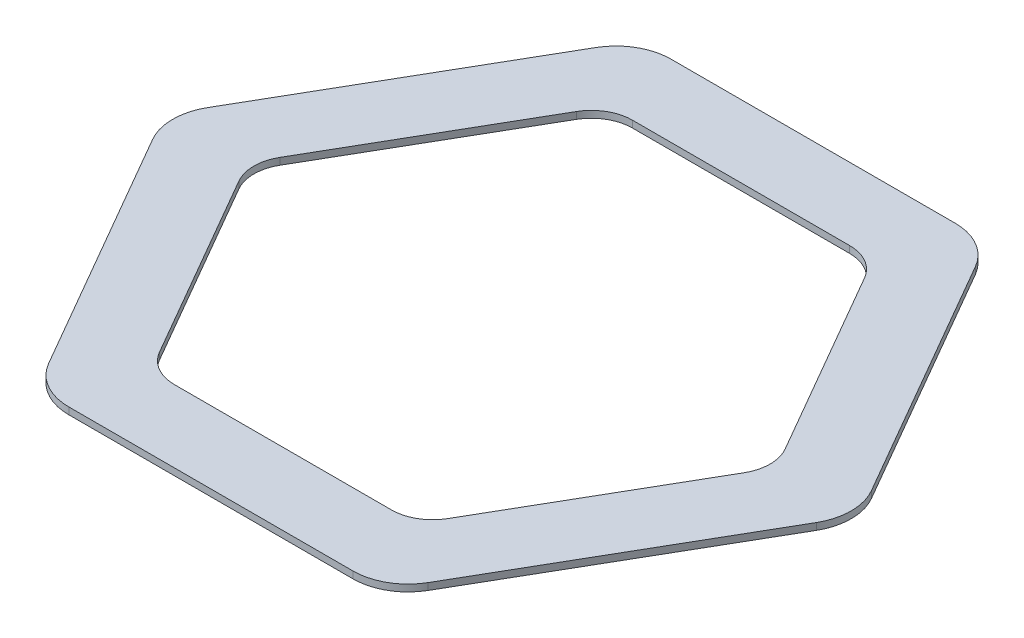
SolidWorks part; units mm, degrees
ref_plane "Plan de face" through (0, 0, 0) normal (0, 0, 1) x (1, 0, 0)
ref_plane "Plan de dessus" through (0, 0, 0) normal (0, 1, 0) x (1, 0, 0)
ref_plane "Plan de droite" through (0, 0, 0) normal (1, 0, 0) x (0, 0, -1)
sketch "Esquisse1" plane through (0, 0, 0) normal (0, 1, 0) x (1, 0, 0)
  line L0 (-55.5122, 80.05) -> (-97.0814, 8.05)
  line L1 (98.7269, 9) -> (57.1577, 81) construction
  line L2 (41.5692, 90) -> (-41.5692, 90) construction
  line L3 (-57.1577, 81) -> (-98.7269, 9) construction
  line L4 (-98.7269, -9) -> (-57.1577, -81) construction
  line L5 (-41.5692, -90) -> (41.5692, -90) construction
  line L6 (57.1577, -81) -> (98.7269, -9) construction
  line L7 (-97.0814, -8.05) -> (-55.5122, -80.05)
  line L8 (-41.5692, -88.1) -> (41.5692, -88.1)
  line L9 (55.5122, -80.05) -> (97.0814, -8.05)
  line L10 (97.0814, 8.05) -> (55.5122, 80.05)
  line L11 (41.5692, 88.1) -> (-41.5692, 88.1)
  line L12 (-42.1466, 61) -> (-73.9008, 6)
  line L13 (72.1688, 5) -> (40.4145, 60) construction
  line L14 (31.7543, 65) -> (-31.7543, 65) construction
  line L15 (-40.4145, 60) -> (-72.1688, 5) construction
  line L16 (-72.1688, -5) -> (-40.4145, -60) construction
  line L17 (-31.7543, -65) -> (31.7543, -65) construction
  line L18 (40.4145, -60) -> (72.1688, -5) construction
  line L19 (-73.9008, -6) -> (-42.1466, -61)
  line L20 (-31.7543, -67) -> (31.7543, -67)
  line L21 (42.1466, -61) -> (73.9008, -6)
  line L22 (73.9008, 6) -> (42.1466, 61)
  line L23 (31.7543, 67) -> (-31.7543, 67)
  circle A0 centre (0, 0) radius 90 construction
  arc A1 (57.1577, 81) -> (41.5692, 90) centre (41.5692, 72) ccw construction
  arc A2 (98.7269, 9) -> (98.7269, -9) centre (83.1384, 0) cw construction
  arc A3 (41.5692, -90) -> (57.1577, -81) centre (41.5692, -72) ccw construction
  arc A4 (-57.1577, -81) -> (-41.5692, -90) centre (-41.5692, -72) ccw construction
  arc A5 (-98.7269, 9) -> (-98.7269, -9) centre (-83.1384, 0) ccw construction
  arc A6 (-41.5692, 90) -> (-57.1577, 81) centre (-41.5692, 72) ccw construction
  arc A7 (-97.0814, 8.05) -> (-97.0814, -8.05) centre (-83.1384, 0) ccw
  arc A8 (-55.5122, -80.05) -> (-41.5692, -88.1) centre (-41.5692, -72) ccw
  arc A9 (41.5692, -88.1) -> (55.5122, -80.05) centre (41.5692, -72) ccw
  arc A10 (97.0814, 8.05) -> (97.0814, -8.05) centre (83.1384, 0) cw
  arc A11 (55.5122, 80.05) -> (41.5692, 88.1) centre (41.5692, 72) ccw
  arc A12 (-41.5692, 88.1) -> (-55.5122, 80.05) centre (-41.5692, 72) ccw
  circle A13 centre (0, 0) radius 65 construction
  arc A14 (40.4145, 60) -> (31.7543, 65) centre (31.7543, 55) ccw construction
  arc A15 (72.1688, 5) -> (72.1688, -5) centre (63.5085, 0) cw construction
  arc A16 (31.7543, -65) -> (40.4145, -60) centre (31.7543, -55) ccw construction
  arc A17 (-40.4145, -60) -> (-31.7543, -65) centre (-31.7543, -55) ccw construction
  arc A18 (-72.1688, 5) -> (-72.1688, -5) centre (-63.5085, 0) ccw construction
  arc A19 (-31.7543, 65) -> (-40.4145, 60) centre (-31.7543, 55) ccw construction
  arc A20 (-73.9008, 6) -> (-73.9008, -6) centre (-63.5085, 0) ccw
  arc A21 (-42.1466, -61) -> (-31.7543, -67) centre (-31.7543, -55) ccw
  arc A22 (31.7543, -67) -> (42.1466, -61) centre (31.7543, -55) ccw
  arc A23 (73.9008, 6) -> (73.9008, -6) centre (63.5085, 0) cw
  arc A24 (42.1466, 61) -> (31.7543, 67) centre (31.7543, 55) ccw
  arc A25 (-31.7543, 67) -> (-42.1466, 61) centre (-31.7543, 55) ccw
  dimension "D1" = 180
  dimension "D2" = 18
  dimension "D5" = 10
  dimension "D4" = 25
  dimension "D3" = 1.9
  dimension "D6" = 2
extrude "Boss.-Extru.1" add sketch "Esquisse1" along normal blind 2
